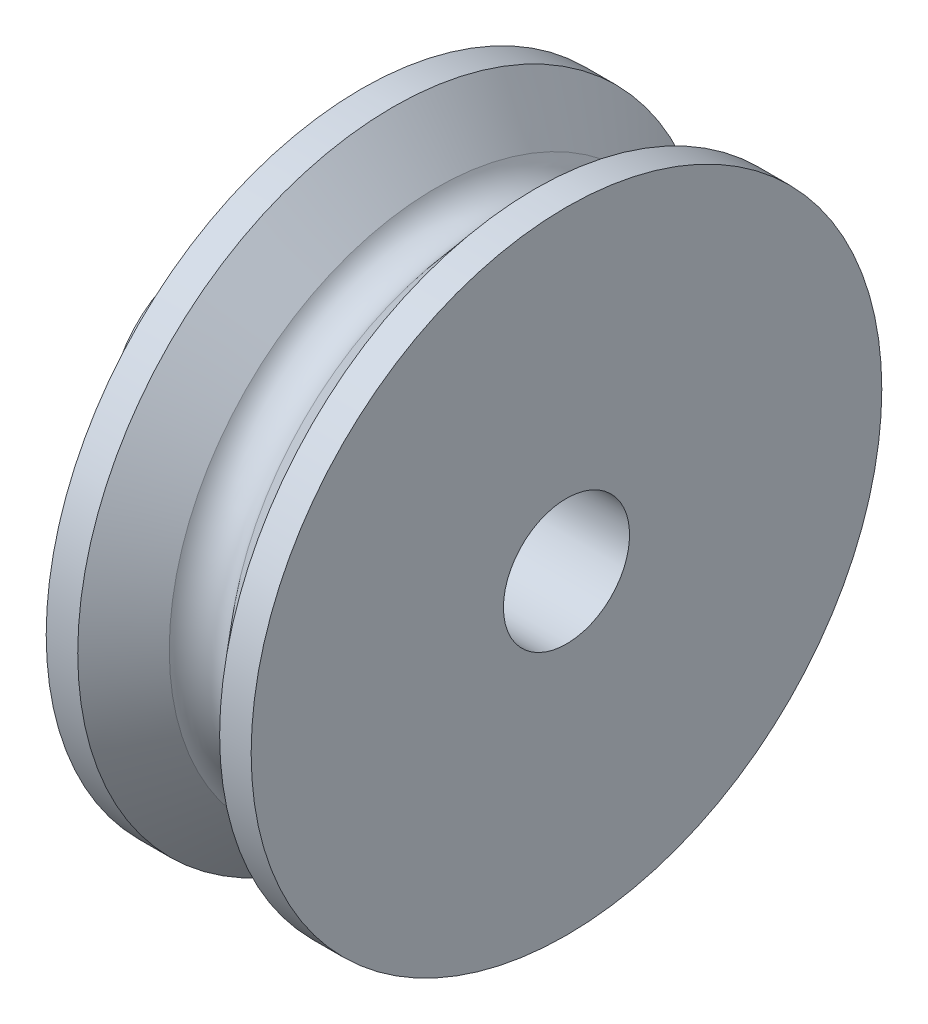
SolidWorks part; units mm, degrees
ref_plane "Front" through (0, 0, 0) normal (0, 0, 1) x (1, 0, 0)
ref_plane "Top" through (0, 0, 0) normal (0, 1, 0) x (1, 0, 0)
ref_plane "Right" through (0, 0, 0) normal (1, 0, 0) x (0, 0, -1)
sketch "Sketch1" plane through (0, 0, 0) normal (0, 0, 1) x (1, 0, 0)
  line L0 (8.1028, 3.5895) -> (14.6028, 3.5895)
  line L1 (14.6028, 5.5895) -> (14.6028, 13.5895)
  line L2 (14.6028, 13.5895) -> (13.6028, 13.5895)
  line L3 (13.6028, 13.5895) -> (12.1142, 11.8412)
  line L4 (3.1028, 5.5895) -> (3.1028, 6.5895)
  line L5 (3.1028, 6.5895) -> (8.1028, 6.5895)
  line L6 (8.1028, 6.5895) -> (8.1028, 13.5895)
  line L7 (8.1028, 13.5895) -> (9.1028, 13.5895)
  line L8 (9.1028, 13.5895) -> (10.4584, 12.0423)
  line L10 (14.6028, 5.5895) -> (3.1028, 5.5895)
  arc A0 (12.1142, 11.8412) -> (10.4584, 12.0423) centre (11.3528, 12.4895) cw
  dimension "D6" = 1
  dimension "D1" = 5
  dimension "D2" = 10
  dimension "D4" = 3
  dimension "D5" = 6.5
  dimension "D7" = 4.5
  dimension "D8" = 6.5
  dimension "D9" = 3.25
  dimension "D10" = 1.1
  dimension "D11" = 1
  dimension "D12" = 1
revolve "Revolve1" add sketch "Sketch1" angle 360 about L0
sketch "Sketch2" plane through (0, 0, 0) normal (0, 0, 1) x (1, 0, 0)
  circle A0 centre (11.3528, 3.5895) radius 0.001
extrude "Cut-Extrude1" cut sketch "Sketch2" against normal mid plane 90
